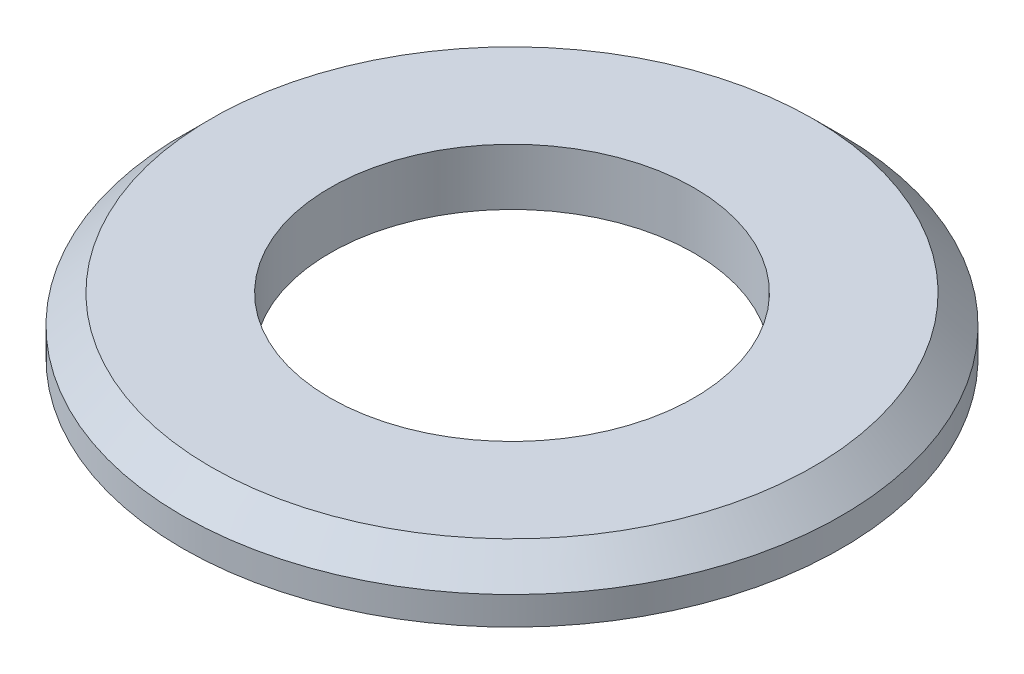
SolidWorks part; units mm, degrees
ref_plane "Front" through (0, 0, 0) normal (0, 0, 1) x (1, 0, 0)
ref_plane "Top" through (0, 0, 0) normal (0, 1, 0) x (1, 0, 0)
ref_plane "Right" through (0, 0, 0) normal (1, 0, 0) x (0, 0, -1)
sketch "Sketch1" plane through (0, 0, 0) normal (0, 1, 0) x (1, 0, 0)
  circle A0 centre (0, 0) radius 29
  circle A1 centre (0, 0) radius 52.5
extrude "Extrude1" add sketch "Sketch1" along normal blind 9
chamfer "Chamfer1" distance 4.5 1 edges at (0, 9, 52.5)
